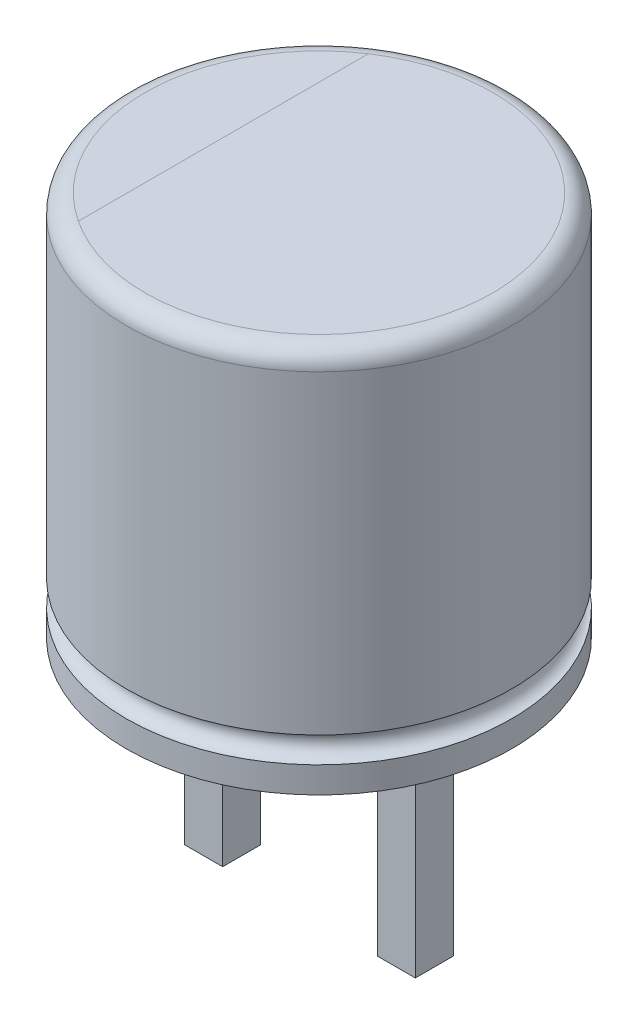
SolidWorks part; units mm, degrees
ref_plane "Front Plane" through (0, 0, 0) normal (0, 0, 1) x (1, 0, 0)
ref_plane "Top Plane" through (0, 0, 0) normal (0, 1, 0) x (1, 0, 0)
ref_plane "Right Plane" through (0, 0, 0) normal (1, 0, 0) x (0, 0, -1)
sketch "Sketch1" plane through (0, 0, 0) normal (0, 0, 1) x (1, 0, 0)
  line L0 (0, 0) -> (0, 5.08)
  line L1 (0, 5.08) -> (2.29, 5.08)
  line L2 (2.54, 4.83) -> (2.54, 0.6844)
  line L3 (2.54, 0.3439) -> (2.54, 0)
  line L4 (2.54, 0) -> (0, 0)
  line L5 (0, 0) -> (0, -17.9077) construction
  arc A0 (2.54, 0.6844) -> (2.54, 0.3439) centre (2.54, 0.5142) ccw
  arc A1 (2.29, 5.08) -> (2.54, 4.83) centre (2.29, 4.83) cw
  dimension "D3" = 0.25
  dimension "D1" = 5.08
  dimension "D2" = 5.08
revolve "Revolve1" add sketch "Sketch1" angle 360 about L5
sketch "Sketch2" plane through (0, 0, 0) normal (0, -1, 0) x (1, 0, 0)
  line L0 (-1.02, 0) -> (1.02, 0) construction
  line L1 (-1.52, 0.25) -> (-1.02, 0.25)
  line L2 (-1.52, 0.25) -> (-1.52, -0.25)
  line L3 (-1.52, -0.25) -> (-1.02, -0.25)
  line L4 (-1.02, 0.25) -> (-1.02, -0.25)
  line L5 (1.02, 0.25) -> (1.52, 0.25)
  line L6 (1.02, 0.25) -> (1.02, -0.25)
  line L7 (1.02, -0.25) -> (1.52, -0.25)
  line L8 (1.52, 0.25) -> (1.52, -0.25)
  point P10 (-1.27, -0.25)
  point P12 (1.27, -0.25)
  dimension "D1" = 0.5
  dimension "D2" = 2.54
extrude "Extrude1" add sketch "Sketch2" along normal blind 3
sketch "Sketch3" plane through (0, 5.08, 0) normal (0, 1, 0) x (1, 0, 0)
  line L0 (-1.2608, 1.9117) -> (-1.2608, -1.9117)
  circle A0 centre (0, 0) radius 2.29 construction
